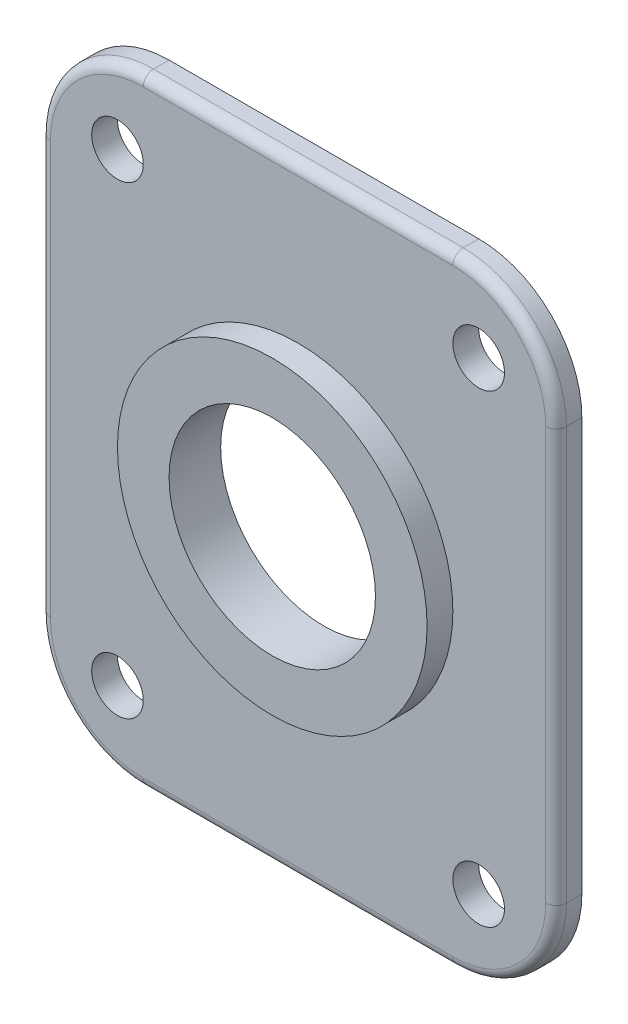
SolidWorks part; units mm, degrees
ref_plane "Front Plane" through (0, 0, 0) normal (0, 0, 1) x (1, 0, 0)
ref_plane "Top Plane" through (0, 0, 0) normal (0, 1, 0) x (1, 0, 0)
ref_plane "Right Plane" through (0, 0, 0) normal (1, 0, 0) x (0, 0, -1)
sketch "Sketch1" plane through (0, 0, 0) normal (0, 0, 1) x (1, 0, 0)
  line L1 (-95.3917, 34.3318) -> (-65.3917, 34.3318)
  line L2 (-95.3917, 34.3318) -> (-95.3917, -25.6682)
  line L3 (-95.3917, -25.6682) -> (-45.3917, -25.6682)
  line L4 (-45.3917, 14.3318) -> (-45.3917, -25.6682)
  arc A0 (-45.3917, 14.3318) -> (-65.3917, 34.3318) centre (-65.3917, 14.3318) ccw
  point P6 (-45.3917, 34.3318)
  dimension "D3" = 20
  dimension "D1" = 50
  dimension "D2" = 60
extrude "Boss-Extrude1" add sketch "Sketch1" along normal blind 5
sketch "Sketch2" plane through (0, 0, 5) normal (0, 0, 1) x (1, 0, 0)
  line L0 (-65.3917, 34.3318) -> (-95.3917, 34.3318) construction
  line L1 (-45.3917, -25.6682) -> (-45.3917, 14.3318) construction
  circle A0 centre (-60.3917, 19.3318) radius 5
  dimension "D1" = 10
  dimension "D2" = 15
  dimension "D3" = 15
extrude "Cut-Extrude1" cut sketch "Sketch2" against normal blind 10 contours A0
mirror "Mirror4" about plane through (-95.3917, 34.3318, 5) normal (1, 0, 0)
mirror "Mirror11" about plane through (-95.3917, -25.6682, 5) normal (0, 1, 0) of "Cut-Extrude1", "Mirror4", "Boss-Extrude1"
sketch "Sketch3" plane through (0, 0, 5) normal (0, 0, 1) x (1, 0, 0)
  line L0 (-145.3917, -25.6682) -> (-22.9253, -25.6682) construction
  line L1 (-145.3917, -65.6682) -> (-145.3917, 14.3318) construction
  line L2 (-65.3917, 34.3318) -> (-125.3917, 34.3318) construction
  line L3 (-95.3917, 34.3318) -> (-95.3917, -74.3214) construction
  circle A0 centre (-95.3917, -25.6682) radius 30
extrude "Boss-Extrude2" add sketch "Sketch3" along normal blind 5
sketch "Sketch4" plane through (0, 0, 10) normal (0, 0, 1) x (1, 0, 0)
  line L0 (-95.3917, -25.6682) -> (-37.4527, -25.6682) construction
  circle A0 centre (-95.3917, -25.6682) radius 20
extrude "Cut-Extrude2" cut sketch "Sketch4" against normal blind 25
fillet "Fillet1" radius 2 8 edges at (-139.5338, -79.8103, 5) (-145.3917, -25.6682, 5) (-139.5338, 28.4739, 5) (-95.3917, 34.3318, 5) (-95.3917, -85.6682, 5) (-51.2496, -79.8103, 5) (-45.3917, -25.6682, 5) (-51.2496, 28.4739, 5)
